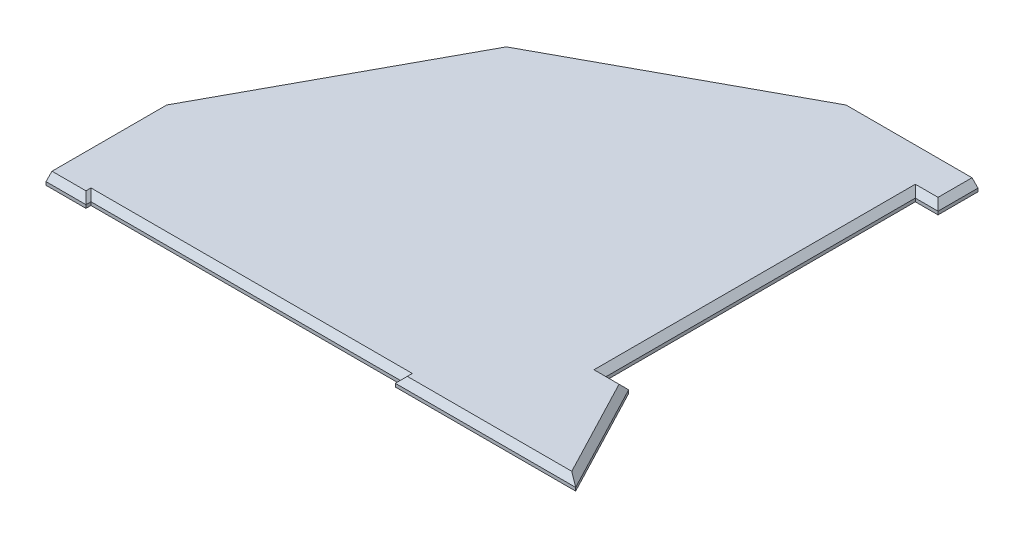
SolidWorks part; units mm, degrees
ref_plane "Front Plane" through (0, 0, 0) normal (1, 0, 0) x (0, 1, 0)
ref_plane "Top Plane" through (0, 0, 0) normal (0, 0, 1) x (0, 1, 0)
ref_plane "Right Plane" through (0, 0, 0) normal (0, 1, 0) x (-1, 0, 0)
sketch "Sketch2" plane through (0, 0, 0) normal (0, 1, 0) x (-1, 0, 0)
  line B0 (604.7159, 547.7126) -> (604.7159, 560.2376)
  line B1 (-418.4966, -491.5527) -> (-475.2966, -491.5527)
  line B2 (604.7159, 547.7126) -> (-169.2841, 547.7126)
  line B3 (-169.2841, 547.7126) -> (-169.2841, 560.2376)
  line B4 (-620.4841, 560.2376) -> (-169.2841, 560.2376)
  line B5 (-620.4841, 560.2376) -> (-475.2966, 282.4473)
  line B6 (-418.4966, 282.4473) -> (-475.2966, 282.4473)
  line B7 (-418.4966, 282.4473) -> (-418.4966, -491.5527)
  line B8 (-475.2966, -491.5527) -> (-475.2966, -591.5527)
  line B9 (-475.2966, -591.5527) -> (-145.1683, -591.5527)
  line B10 (-145.1683, -591.5527) -> (405.7448, -292.5815)
  line B11 (405.7448, -292.5815) -> (704.7159, 258.3315)
  line B12 (704.7159, 560.2376) -> (704.7159, 258.3315)
  line B13 (604.7159, 560.2376) -> (704.7159, 560.2376)
sketch_block_instance "Block3-1"
sketch_block "Block3" parameters "D1"=6, "D2"=6, "D3"=6
extrude "Boss-Extrude2" add sketch "Sketch2" along normal mid plane 38.1
chamfer "Chamfer1" distance 15 angle 45 20 edges at (-654.7159, -19.05, 560.2376) (-604.7159, -19.05, 553.9751) (-217.7159, -19.05, 547.7126) (169.2841, -19.05, 553.9751) (394.8841, -19.05, 560.2376) (475.2966, -19.05, -541.5527) (446.8966, -19.05, -491.5527) (418.4966, -19.05, -104.5527) (446.8966, -19.05, 282.4473) (547.8903, -19.05, 421.3425) (-654.7159, 19.05, 560.2376) (-604.7159, 19.05, 553.9751) (-217.7159, 19.05, 547.7126) (169.2841, 19.05, 553.9751) (394.8841, 19.05, 560.2376) (475.2966, 19.05, -541.5527) (446.8966, 19.05, -491.5527) (418.4966, 19.05, -104.5527) (446.8966, 19.05, 282.4473) (547.8903, 19.05, 421.3425)
